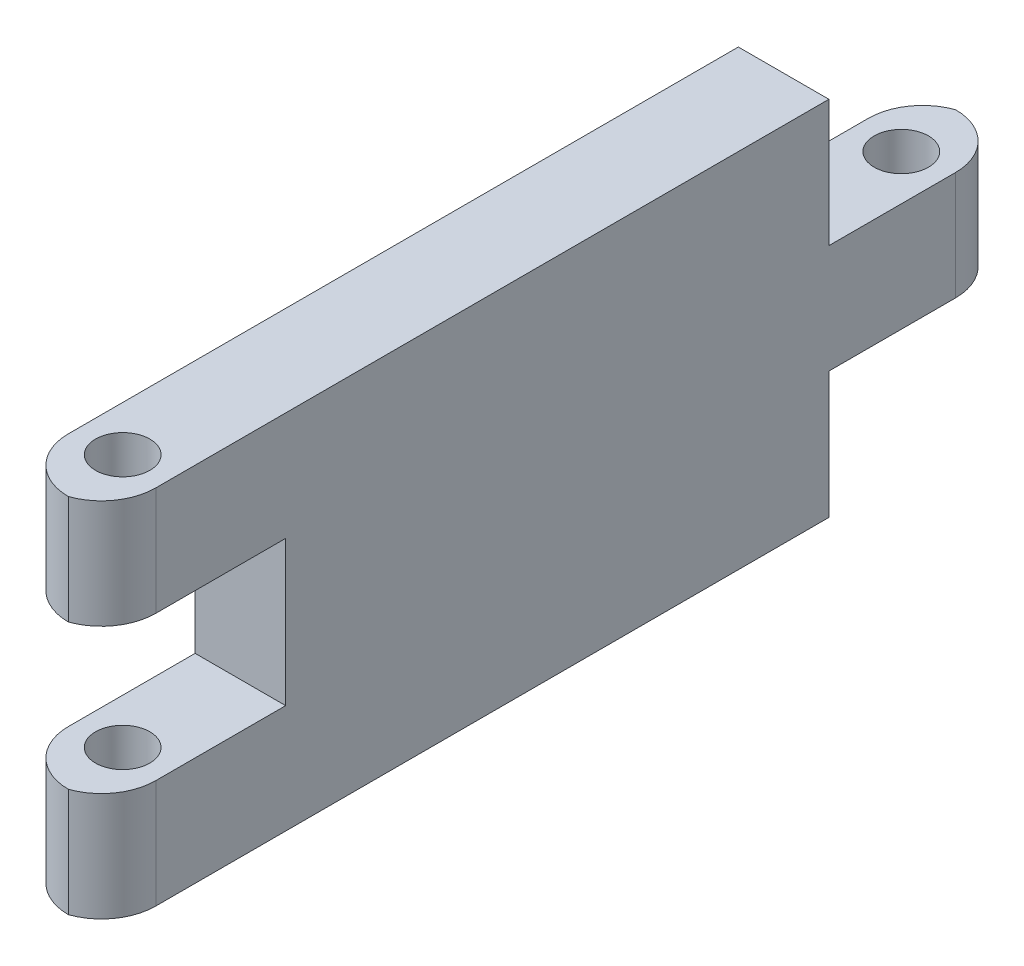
SolidWorks part; units mm, degrees
ref_plane "Front Plane" through (0, 0, 0) normal (0, 0, 1) x (1, 0, 0)
ref_plane "Top Plane" through (0, 0, 0) normal (0, 1, 0) x (1, 0, 0)
ref_plane "Right Plane" through (0, 0, 0) normal (1, 0, 0) x (0, 0, -1)
sketch "Sketch1" plane through (0, 0, 0) normal (1, 0, 0) x (0, 0, -1)
  line L1 (0, 0) -> (30, 0)
  line L2 (0, 0) -> (0, 20)
  line L3 (0, 20) -> (30, 20)
  line L4 (30, 0) -> (30, 20)
  dimension "D1" = 20
  dimension "D2" = 30
extrude "Boss-Extrude1" add sketch "Sketch1" along normal blind 5
sketch "Sketch3" plane through (0, 0, 0) normal (0, 0, 1) x (1, 0, 0)
  line L0 (5, 20) -> (5, 0) construction
  line L1 (0, 0) -> (5, 0)
  line L2 (0, 0) -> (0, 6)
  line L3 (0, 6) -> (5, 6)
  line L4 (5, 0) -> (5, 6)
  dimension "D1" = 6
extrude "Boss-Extrude2" add sketch "Sketch3" along normal blind 10
sketch "Sketch4" plane through (0, 0, 0) normal (0, 0, 1) x (1, 0, 0)
  line L0 (5, 20) -> (5, 6) construction
  line L1 (0, 20) -> (5, 20)
  line L2 (0, 20) -> (0, 14)
  line L3 (0, 14) -> (5, 14)
  line L4 (5, 20) -> (5, 14)
  dimension "D1" = 6
extrude "Boss-Extrude3" add sketch "Sketch4" along normal blind 10 contours L2 L1 L4 L3
fillet "Fillet7" radius 3 1 edges at (0, 3, 10)
fillet "Fillet8" radius 3 1 edges at (5, 3, 10)
fillet "Fillet9" radius 3 1 edges at (0, 17, 10)
fillet "Fillet10" radius 3 1 edges at (5, 17, 10)
sketch "Sketch5" plane through (0, 20, 0) normal (0, 1, 0) x (1, 0, 0)
  line L0 (5, 30) -> (5, -7.1716) construction
  circle A0 centre (2.5, -6.5) radius 1.5
  dimension "D1" = 3
  dimension "D2" = 2.5
  dimension "5" = 6.5
extrude "Cut-Extrude1" cut sketch "Sketch5" against normal through all both and the other way through all contours A0
sketch "Sketch6" plane through (0, 0, -30) normal (0, 0, -1) x (-1, 0, 0)
  line L0 (-5, 0) -> (-5, 20) construction
  line L1 (-5, 13) -> (0, 13)
  line L2 (-5, 13) -> (-5, 7)
  line L3 (-5, 7) -> (0, 7)
  line L4 (0, 13) -> (0, 7)
  line L5 (0, 0) -> (0, 20) construction
  line L6 (-5, 20) -> (0, 20) construction
  point P10 (-2.5, 20)
  dimension "D1" = 6
  dimension "D2" = 7
extrude "Boss-Extrude4" add sketch "Sketch6" along normal blind 10
fillet "Fillet11" radius 3 1 edges at (5, 10, -40)
fillet "Fillet12" radius 3 1 edges at (0, 10, -40)
sketch "Sketch7" plane through (0, 7, 0) normal (0, -1, 0) x (-1, 0, 0)
  line L0 (-5, 30) -> (0, 30) construction
  line L1 (0, 37.1716) -> (0, 30) construction
  circle A0 centre (-2.5, 36.5) radius 1.5
  dimension "D1" = 3
  dimension "D2" = 2.5
  dimension "D3" = 6.5
extrude "Cut-Extrude2" cut sketch "Sketch7" against normal through all both and the other way through all contours A0
